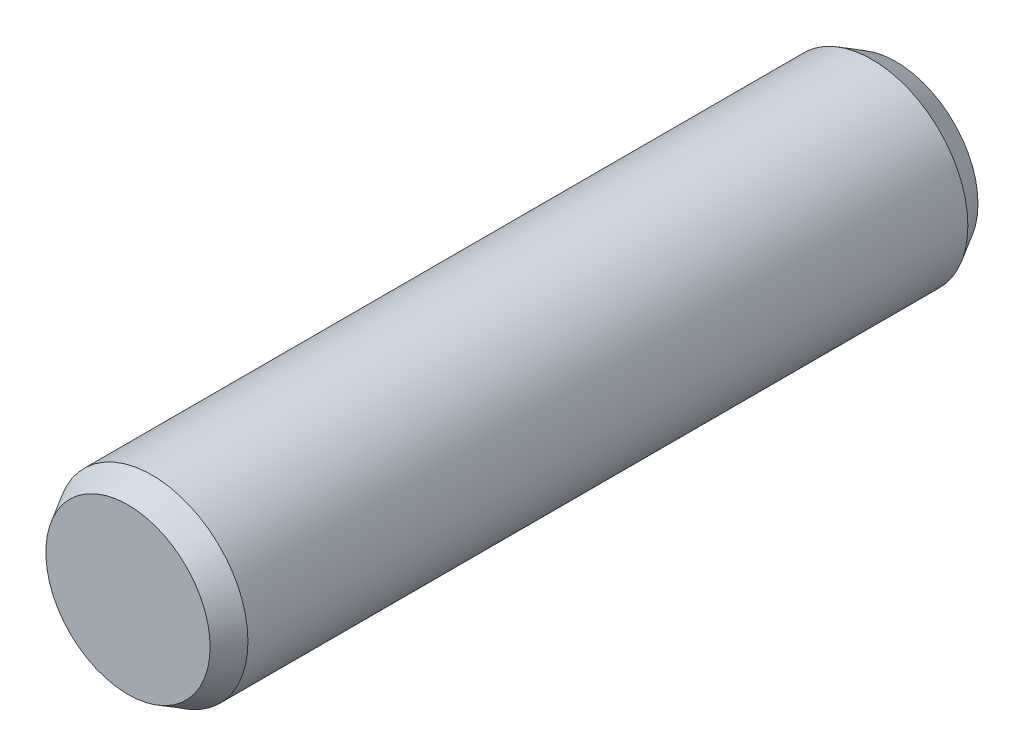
SolidWorks part; units mm, degrees
ref_plane "Plan1" through (0, 0, 0) normal (0, 0, 1) x (1, 0, 0)
ref_plane "Plan2" through (0, 0, 0) normal (0, 1, 0) x (1, 0, 0)
ref_plane "Plan3" through (0, 0, 0) normal (1, 0, 0) x (0, 0, -1)
sketch "Esquisse1" plane through (0, 0, 0) normal (0, 0, 1) x (1, 0, 0)
  circle A0 centre (50, 10) radius 4
  dimension "D1" = 8
extrude "Base-Extrusion" add sketch "Esquisse1" along normal blind 32
chamfer "Chanfrein1" distance 1 angle 30
